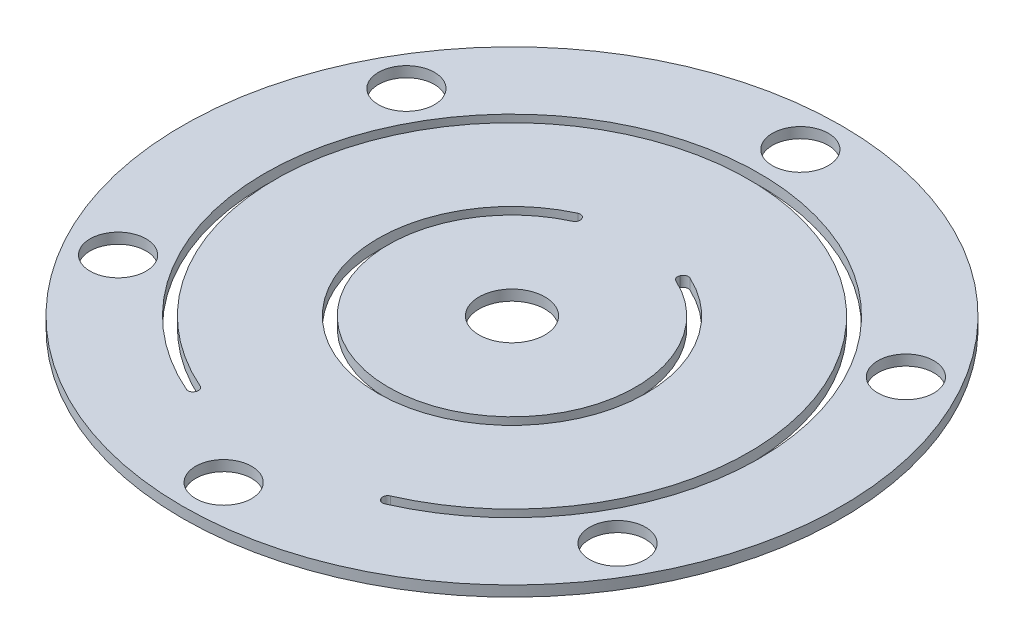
SolidWorks part; units mm, degrees
ref_plane "Front" through (0, 0, 0) normal (0, 0, 1) x (1, 0, 0)
ref_plane "Top" through (0, 0, 0) normal (0, 1, 0) x (1, 0, 0)
ref_plane "Right" through (0, 0, 0) normal (1, 0, 0) x (0, 0, -1)
sketch "Sketch1" plane through (0, 0, 0) normal (0, 1, 0) x (1, 0, 0)
  circle A0 centre (0, 0) radius 25.4
  dimension "D1" = 50.8
extrude "Boss-Extrude1" add sketch "Sketch1" along normal blind 0.8128
sketch "Sketch2" plane through (0, 0.8128, 0) normal (0, 1, 0) x (1, 0, 0)
  line L0 (-7.8612, 25.4) -> (8.2377, 25.4) construction
  line L1 (-7.8612, 19.05) -> (8.2377, 19.05) construction
  line L2 (0, 25.4) -> (0, 22.225) construction
  line L3 (0, 22.225) -> (0, 19.05) construction
  circle A0 centre (0, 22.225) radius 2.159
  circle A1 centre (0, 0) radius 25.4 construction
  point P8 (0, 25.4)
  dimension "D2" = 4.318
  dimension "D1" = 6.35
extrude "6x#6 clearance hole" cut sketch "Sketch2" against normal through all
pattern_circular "CirPattern1" count 6 over 360 about axis through (0, 0, 0) along (0, 1, 0) of "6x#6 clearance hole"
sketch "Sketch3" plane through (0, 0.8128, 0) normal (0, 1, 0) x (1, 0, 0)
  circle A0 centre (0, 0) radius 2.54
  dimension "D1" = 5.08
extrude "Center #10 Clearance hole close fit" cut sketch "Sketch3" against normal through all
sketch "Exterior Ring" plane through (0, 0.8128, 0) normal (0, 1, 0) x (1, 0, 0)
  circle A0 centre (0, 0) radius 25.4 construction
  circle A1 centre (0, 0) radius 25.4
  circle A2 centre (0, 0) radius 19.05
  point P5 (0, 19.05)
  point P6 (0, -19.05)
  dimension "D1" = 6.35
sketch "Interior Shaft Mount" plane through (0, 0.8128, 0) normal (0, 1, 0) x (1, 0, 0)
  circle A0 centre (0, 0) radius 9.525
  point P3 (0, 9.525)
  point P4 (0, -19.05)
  dimension "D1" = 19.05
sketch "C-planning" plane through (0, 0.8128, 0) normal (0, 1, 0) x (1, 0, 0)
  line L3 (0, 0) -> (-3.9561, 9.5509) construction
  line L4 (0, 0) -> (3.9561, 9.5509) construction
  line L5 (0, 0) -> (-7.2901, -17.5999) construction
  line L6 (0, 0) -> (7.2901, -17.5999) construction
  arc A1 (-3.9561, 9.5509) -> (3.9561, 9.5509) centre (0, 0) ccw
  arc A2 (7.2901, -17.5999) -> (-7.2901, -17.5999) centre (0, 0) ccw
  dimension "D4" = 20.6756
  dimension "D5" = 38.1
  dimension "D7" = 45
  dimension "D9" = 45
sketch "Sketch7" plane through (0, 0.8128, 0) normal (0, 1, 0) x (1, 0, 0)
  line L0 (0, 0) -> (-3.9561, 9.5509) construction
  line L1 (0, 0) -> (3.9561, 9.5509) construction
  line L2 (-3.9561, 9.5509) -> (-3.6451, 8.8)
  line L3 (3.9561, 9.5509) -> (3.6451, 8.8)
  arc A0 (-3.9561, 9.5509) -> (3.9561, 9.5509) centre (0, 0) ccw construction
  arc A1 (-3.9561, 9.5509) -> (3.9561, 9.5509) centre (0, 0) ccw
  arc A2 (-3.6451, 8.8) -> (3.6451, 8.8) centre (0, 0) ccw
  point P4 (3.6451, 8.8)
  point P5 (-3.6451, 8.8)
  dimension "D1" = 0.8128
extrude "Cut Inside C" cut sketch "Sketch7" against normal through all
fillet "Fillet1" radius 0.381 4 edges at (3.6451, 0.4064, -8.8) (3.9561, 0.4064, -9.5509) (-3.6451, 0.4064, -8.8) (-3.9561, 0.4064, -9.5509)
sketch "Sketch8" plane through (0, 0.8128, 0) normal (0, 1, 0) x (1, 0, 0)
  line L0 (-7.2901, -17.5999) -> (-6.9791, -16.849)
  line L1 (0, 0) -> (-7.2901, -17.5999) construction
  line L2 (7.2901, -17.5999) -> (6.9791, -16.849)
  line L3 (0, 0) -> (7.2901, -17.5999) construction
  arc A0 (7.2901, -17.5999) -> (-7.2901, -17.5999) centre (0, 0) ccw construction
  arc A1 (7.2901, -17.5999) -> (-7.2901, -17.5999) centre (0, 0) ccw
  arc A2 (6.9791, -16.849) -> (-6.9791, -16.849) centre (0, 0) ccw
  dimension "D1" = 0.8128
extrude "Cut Outside C" cut sketch "Sketch8" against normal through all
fillet "Fillet3" radius 0.381 4 edges at (7.2901, 0.4064, 17.5999) (6.9791, 0.4064, 16.849) (-6.9791, 0.4064, 16.849) (-7.2901, 0.4064, 17.5999)
sketch "Flexure width measure" plane through (0, 0.8128, 0) normal (0, 1, 0) x (1, 0, 0)
  line L1 (10.3378, 0) -> (18.2372, 0) construction
  arc A1 (-4.3187, 9.3925) -> (4.3187, 9.3925) centre (0, 0) ccw construction
  arc A2 (7.3224, -16.7026) -> (-7.3224, -16.7026) centre (0, 0) ccw construction
  dimension "D1" = 7.8994
sketch "Bolt-circle measurement (1.750)" plane through (0, 0.8128, 0) normal (0, 1, 0) x (1, 0, 0)
  line L0 (0, 0) -> (-21.1172, 12.192) construction
  line L1 (-21.1172, 12.192) -> (-21.997, 12.7) construction
  circle A0 centre (-19.2474, 11.1125) radius 2.159 construction
  circle A1 centre (0, 0) radius 25.4 construction
  circle A2 centre (-19.2474, 11.1125) radius 2.159
  point P5 (-19.2474, 11.1125)
sketch "Centering C-cut sketch" plane through (0, 0.8128, 0) normal (0, 1, 0) x (1, 0, 0)
  line L0 (-7.0944, -17.0516) -> (7.0944, -17.0516) construction
  line L1 (-3.7591, 8.9994) -> (3.7591, 8.9994) construction
  line L2 (0, 0) -> (0, 8.9994) construction
  line L3 (0, 0) -> (0, -17.0516) construction
  arc A0 (-3.9808, 8.6532) -> (-3.7881, 9.1452) centre (-4.1401, 8.9994) ccw construction
  arc A1 (3.7881, 9.1452) -> (3.9808, 8.6532) centre (4.1401, 8.9994) ccw construction
  arc A2 (-7.1234, -17.1974) -> (-7.3224, -16.7026) centre (-7.4754, -17.0516) ccw construction
  arc A3 (7.3224, -16.7026) -> (7.1234, -17.1974) centre (7.4754, -17.0516) ccw construction
  point P0 (-3.7591, 8.9994)
  point P1 (3.7591, 8.9994)
  point P5 (-7.0944, -17.0516)
  point P9 (7.0944, -17.0516)
  dimension "D1" = 8.9994
  dimension "D2" = 17.0516
